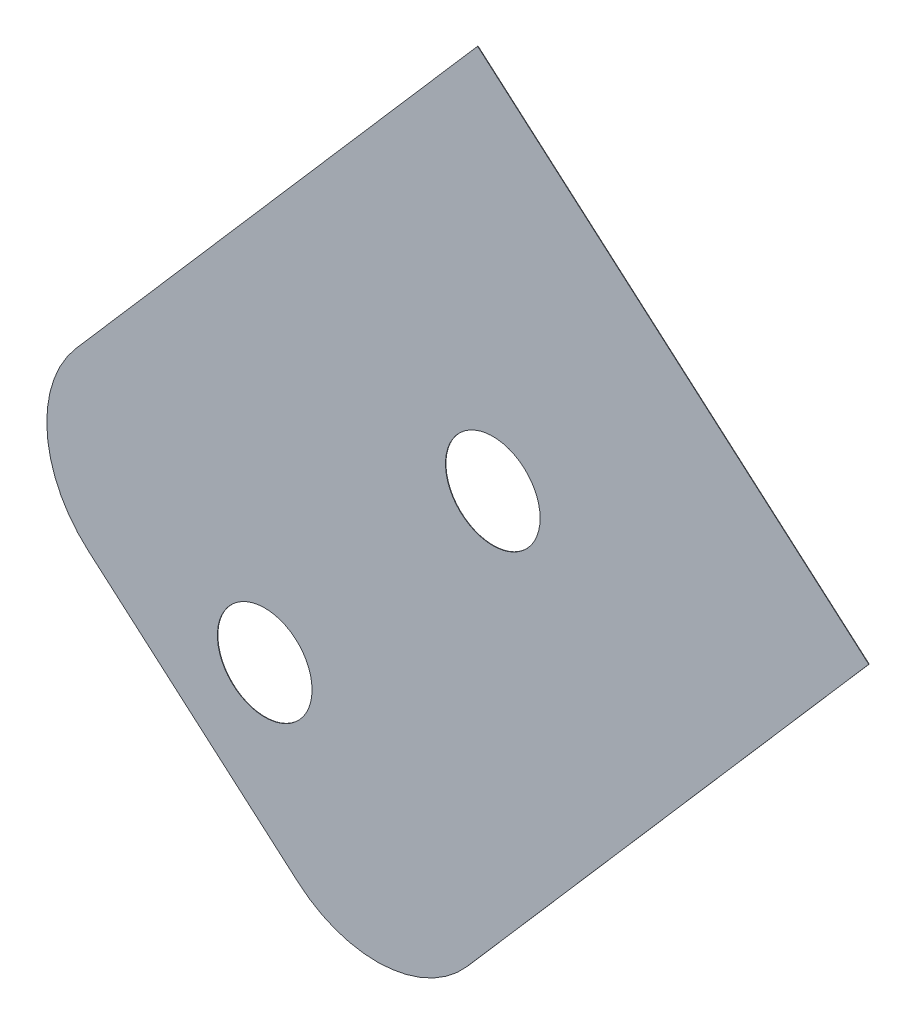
SolidWorks part; units mm, degrees
ref_plane "Front" through (0, 0, 0) normal (0, 0, 1) x (1, 0, 0)
ref_plane "Top" through (0, 0, 0) normal (0, 1, 0) x (1, 0, 0)
ref_plane "Right" through (0, 0, 0) normal (1, 0, 0) x (0, 0, -1)
sketch "Sketch1" plane through (0, 0, 0) normal (0, 0, 1) x (1, 0, 0)
  line L8 (-659.0941, -81.3244) -> (-682.2992, -61.1724)
  line L9 (-682.9101, -108.7486) -> (-659.0941, -81.3244)
  line L10 (-705.4087, -98.6297) -> (-692.9431, -109.4551)
  line L11 (-682.2992, -61.1724) -> (-706.1152, -88.5966)
  line L12 (-659.0941, -81.3244) -> (-682.2992, -61.1724)
  line L13 (-682.9101, -108.7486) -> (-659.0941, -81.3244)
  line L14 (-705.4087, -98.6297) -> (-692.9431, -109.4551)
  line L15 (-682.2992, -61.1724) -> (-706.1152, -88.5966)
  arc A4 (-692.9431, -109.4551) -> (-682.9101, -108.7486) centre (-688.2799, -104.0853) ccw
  arc A5 (-706.1152, -88.5966) -> (-705.4087, -98.6297) centre (-700.7454, -93.2599) ccw
  arc A6 (-692.9431, -109.4551) -> (-682.9101, -108.7486) centre (-688.2799, -104.0853) ccw
  arc A7 (-706.1152, -88.5966) -> (-705.4087, -98.6297) centre (-700.7454, -93.2599) ccw
  dimension "D1" = 0.508
extrude "Boss-Extrude1" add sketch "Sketch1" along normal blind 0.0254 separate body
hole_wizard "Hole1" positions "Point_Sketch" profile "Profil_Sketch" hole size "Ø0.15" standard "ISO"
sketch "Point_Sketch" plane through (-685.0515, -72.969, 0.0254) normal (0, 0, -1) x (1, 0, 0)
  point P0 (3.6543, 10.6011)
  point P2 (-9.8775, 26.1831)
sketch "Profil_Sketch" plane through (-681.3972, -83.5701, 0.0254) normal (1, 0, 0) x (0, -1, 0)
  line L0 (0, 0) -> (0, 0.0254)
  line L1 (0, 0.0254) -> (2.8067, 0.0254)
  line L2 (2.8067, 0.0254) -> (2.8067, 0)
  line L5 (2.8067, 0) -> (0, 0)
  line L11 (0, -6.35) -> (0, 107.95) construction
  dimension "Diameter" = 5.6134
  dimension "Thru Hole Depth" = 0.0254
other "usin_DL090_10-24x1.75-SHCS<1>"
